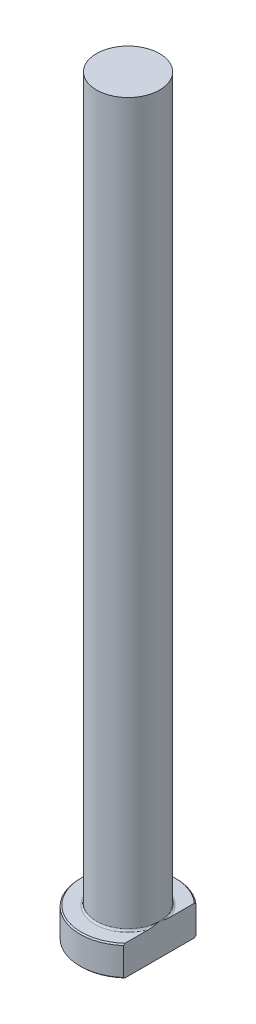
SolidWorks part; units mm, degrees
ref_plane "Front Plane" through (0, 0, 0) normal (0, 0, 1) x (1, 0, 0)
ref_plane "Top Plane" through (0, 0, 0) normal (0, 1, 0) x (1, 0, 0)
ref_plane "Right Plane" through (0, 0, 0) normal (1, 0, 0) x (0, 0, -1)
sketch "Sketch1" plane through (0, 0, 0) normal (0, 0, 1) x (1, 0, 0)
  line L0 (0, 259.9588) -> (0, -15.1925) construction
  line L1 (0, 0) -> (-8, 0)
  line L2 (-8, 0) -> (-8, 5)
  line L3 (-8, 5) -> (-5.25, 5)
  line L4 (-5.25, 5) -> (-5.25, 125)
  line L5 (-5.25, 125) -> (0, 125)
  line L6 (0, 125) -> (0, 0)
  dimension "L" = 125
  dimension "H" = 16
  dimension "T" = 5
  dimension "D" = 10.5
revolve "Revolve1" add sketch "Sketch1" angle 360 about L0
chamfer "Chamfer1" distance 0.2 angle 45 2 edges at (0, 5, 8) (0, 0, 8)
fillet "Fillet1" radius 0.3 1 edges at (0, 5, 5.25)
sketch "Sketch2" plane through (0, 0, 0) normal (0, 1, 0) x (1, 0, 0)
  line L0 (5.25, 6.0363) -> (5.25, -6.0363)
  circle A0 centre (0, 0) radius 8 construction
  arc A1 (5.25, -6.0363) -> (5.25, 6.0363) centre (0, 0) ccw
  circle A2 centre (0, 0) radius 5.25 construction
extrude "KEY" cut sketch "Sketch2" along normal through all
